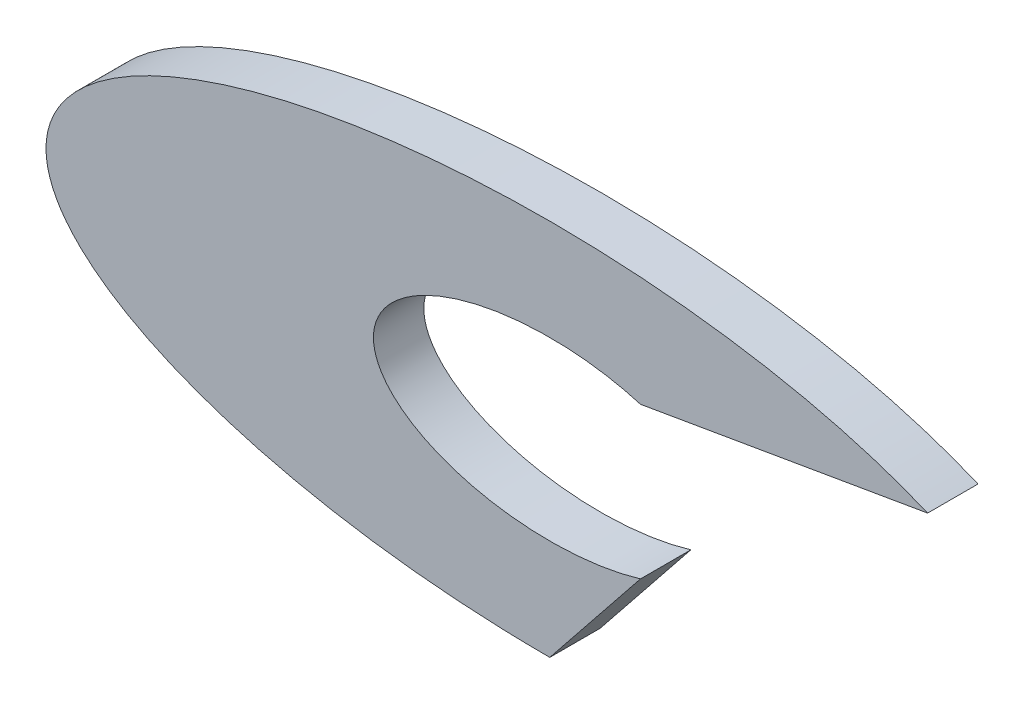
SolidWorks part; units mm, degrees
ref_plane "Front Plane" through (0, 0, 0) normal (0, 0, 1) x (1, 0, 0)
ref_plane "Top Plane" through (0, 0, 0) normal (0, 1, 0) x (1, 0, 0)
ref_plane "Right Plane" through (0, 0, 0) normal (1, 0, 0) x (0, 0, -1)
sketch "Sketch1" plane through (0, 0, 0) normal (0, 0, 1) x (1, 0, 0)
  line L0 (18, 15.0083) -> (75, 24.8039)
  line L1 (18, -15.0083) -> (0, -37.5)
  ellipse E0 centre (0, 0) end of major axis (100, 0) minor radius 37.5 (0, -37.5) -> (75, 24.8039) ccw construction
  ellipse E1 centre (0, 0) end of major axis (35, 0) minor radius 17.5 (18, -15.0083) -> (18, 15.0083) ccw construction
  ellipse E2 centre (0, 0) end of major axis (100, 0) minor radius 37.5 (75, 24.8039) -> (0, -37.5) ccw
  ellipse E3 centre (0, 0) end of major axis (35, 0) minor radius 17.5 (18, 15.0083) -> (18, -15.0083) ccw
  dimension "D3" = 70
  dimension "D1" = 200
  dimension "D2" = 75
  dimension "D4" = 35
  dimension "D5" = 75
  dimension "D7" = 18
extrude "Extrude1" add sketch "Sketch1" along normal blind 10
